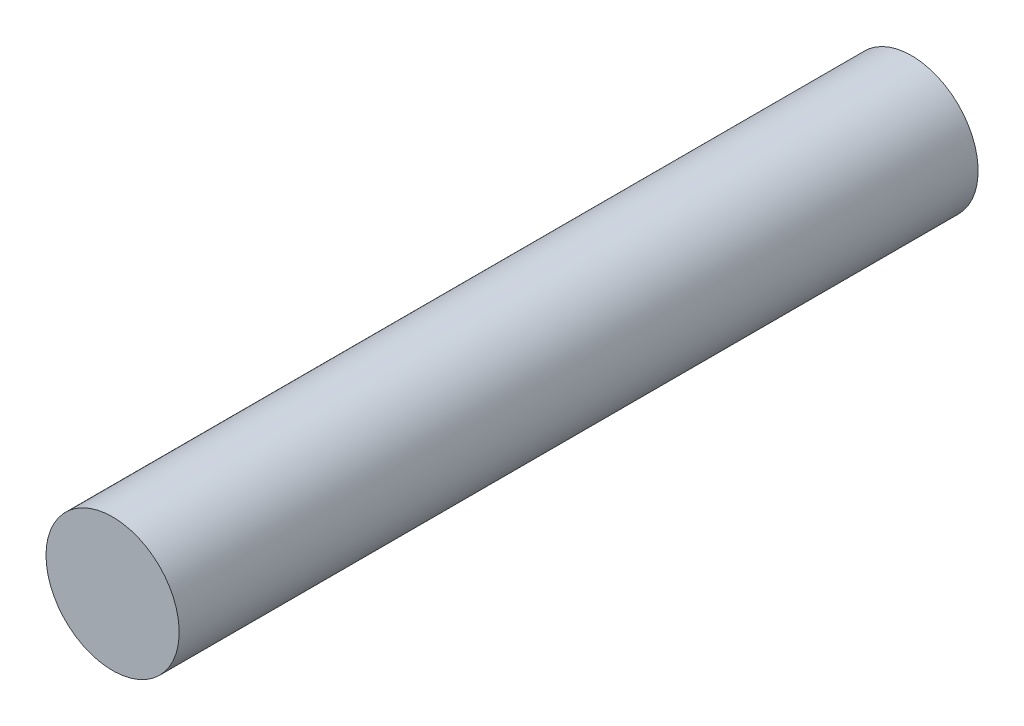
SolidWorks part; units mm, degrees
ref_plane "Plane1" through (0, 0, 0) normal (0, 0, 1) x (1, 0, 0)
ref_plane "Plane2" through (0, 0, 0) normal (0, 1, 0) x (1, 0, 0)
ref_plane "Plane3" through (0, 0, 0) normal (1, 0, 0) x (0, 0, -1)
sketch "Sketch1" plane through (0, 0, 0) normal (0, 0, 1) x (1, 0, 0)
  circle A0 centre (0, 0) radius 12.7
  dimension "D1" = 25.4
extrude "Base-Extrude" add sketch "Sketch1" along normal blind 152.4
